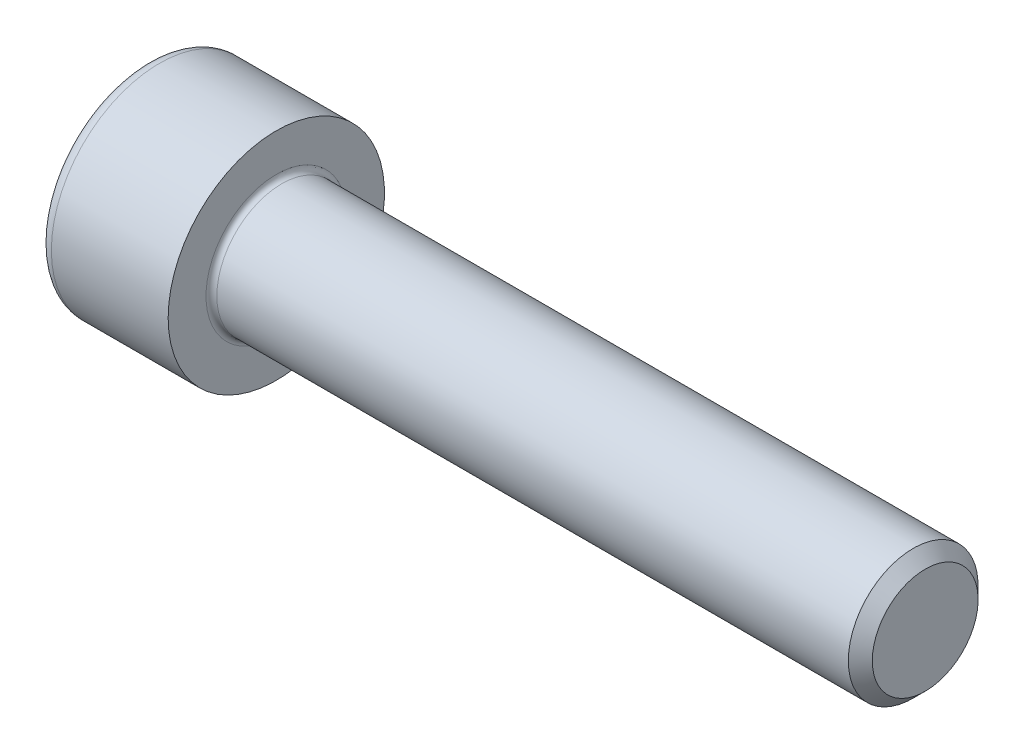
SolidWorks part; units mm, degrees
ref_plane "Plane1" through (0, 0, 0) normal (0, 0, 1) x (1, 0, 0)
ref_plane "Plane2" through (0, 0, 0) normal (0, 1, 0) x (1, 0, 0)
ref_plane "Plane3" through (0, 0, 0) normal (1, 0, 0) x (0, 0, -1)
other "PropertyManager"
sketch "BodySke" plane through (0, 0, 0) normal (0, 0, 1) x (1, 0, 0)
  line L0 (0, 0) -> (0, 5)
  line L1 (0, 5) -> (6, 5)
  line L2 (6, 5) -> (6, 3)
  line L3 (6, 3) -> (35.4455, 3)
  line L4 (36, 2.4455) -> (36, 0)
  line L5 (36, 0) -> (0, 0)
  line L6 (-31.75, 0) -> (127, 0) construction
  line L8 (36, 2.4455) -> (35.4455, 3)
  line L10 (36, -2.4455) -> (35.4455, -3) construction
  line L11 (7, 9.525) -> (7, 3.175) construction
  line L12 (14, 9.525) -> (14, 3.175) construction
  line L13 (-24, 9.525) -> (-24, 3.175) construction
  dimension "Diameter" = 6
  dimension "Head_ht" = 6
  dimension "Length" = 30
  dimension "Body_ch_ang" = 45
  dimension "Head_dia" = 10
  dimension "Minor_dia" = 4.891
  dimension "Advance" = 1
  dimension "Thread_nom" = 22
  dimension "Thread_length" = 60
revolve "Base-Revolve" add sketch "BodySke" angle 360 about L6
fillet "Fillet1" radius 0.25
fillet "Fillet2" radius 0.6
sketch "Sketch2" plane through (0, 0, 0) normal (0, 0, 1) x (1, 0, 0)
  line L0 (0, 2.51) -> (3, 2.51)
  line L1 (3, 2.51) -> (4.4491, 0)
  line L2 (-31.75, 0) -> (127, 0) construction
  line L3 (4.4491, 0) -> (0, 0)
  line L4 (0, 0) -> (0, 2.51)
  line L6 (0, 0) -> (47.625, 0) construction
  dimension "D1" = 2.51
  dimension "D2" = 60
  dimension "Depth" = 3
revolve "Hex-PreBroach" cut sketch "Sketch2" angle 360 about L6
sketch "Sketch3" plane through (0, 0, 0) normal (-1, 0, 0) x (0, 0.5, 0.866)
  line L0 (1.4491, 2.51) -> (-1.4491, 2.51)
  line L1 (-1.4491, 2.51) -> (-2.8983, 0)
  line L2 (1.4491, 2.51) -> (2.8983, 0)
  line L3 (1.4491, -2.51) -> (2.8983, 0)
  line L4 (1.4491, -2.51) -> (-1.4491, -2.51)
  line L5 (-1.4491, -2.51) -> (-2.8983, 0)
  dimension "D1" = 2.51
  dimension "D2" = 2.51
  dimension "Hex_size" = 5.02
extrude "Hex" cut sketch "Sketch3" against normal blind 3
equation "\"D2@Sketch3\" = \"Hex_size@Sketch3\" / 2"
equation "\"D1@Sketch3\" = \"Hex_size@Sketch3\" / 2"
equation "\"D1@Sketch2\" = \"Hex_size@Sketch3\" / 2"
equation "\"Depth@Sketch2\" =  \"Key_eng@Hex\""
